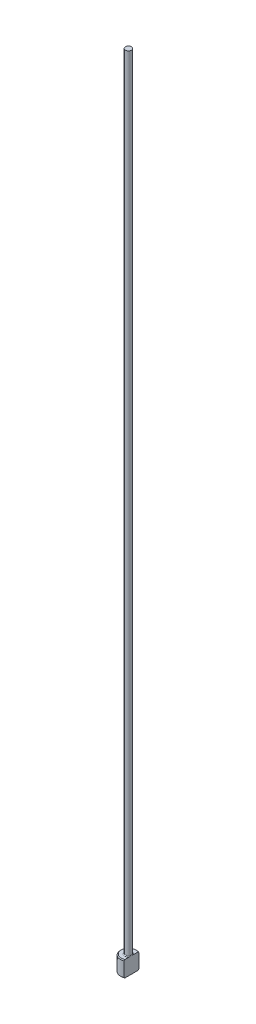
SolidWorks part; units mm, degrees
ref_plane "Front Plane" through (0, 0, 0) normal (0, 0, 1) x (1, 0, 0)
ref_plane "Top Plane" through (0, 0, 0) normal (0, 1, 0) x (1, 0, 0)
ref_plane "Right Plane" through (0, 0, 0) normal (1, 0, 0) x (0, 0, -1)
sketch "Sketch1" plane through (0, 0, 0) normal (0, 0, 1) x (1, 0, 0)
  line L0 (0, 259.9588) -> (0, -15.1925) construction
  line L1 (0, 0) -> (-2, 0)
  line L2 (-2, 0) -> (-2, 4)
  line L3 (-2, 4) -> (-0.75, 4)
  line L4 (-0.75, 4) -> (-0.75, 200)
  line L5 (-0.75, 200) -> (0, 200)
  line L6 (0, 200) -> (0, 0)
  dimension "L" = 200
  dimension "H" = 4
  dimension "T" = 4
  dimension "D" = 1.5
revolve "Revolve1" add sketch "Sketch1" angle 360 about L0
chamfer "Chamfer1" distance 0.2 angle 45 2 edges at (0, 4, 2) (0, 0, 2)
fillet "Fillet1" radius 0.2 1 edges at (0, 4, 0.75)
sketch "Sketch2" plane through (0, 0, 0) normal (0, 1, 0) x (1, 0, 0)
  line L0 (0.75, -1.854) -> (0.75, 1.854)
  circle A0 centre (0, 0) radius 2 construction
  arc A1 (0.75, -1.854) -> (0.75, 1.854) centre (0, 0) ccw
  circle A2 centre (0, 0) radius 0.75 construction
extrude "KEYED HEAD" cut sketch "Sketch2" along normal through all
